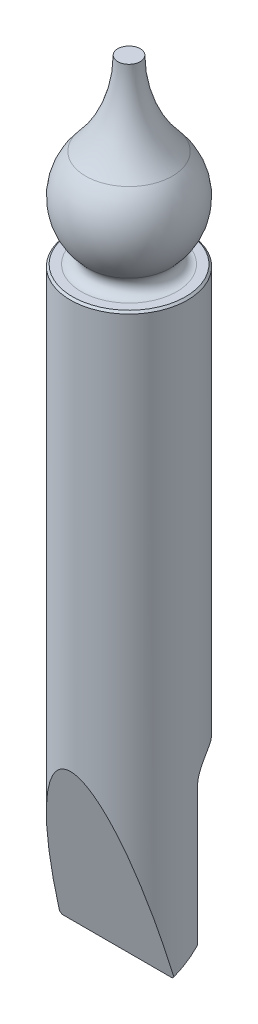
SolidWorks part; units mm, degrees
ref_plane "Спереди" through (0, 0, 0) normal (0, 0, 1) x (1, 0, 0)
ref_plane "Сверху" through (0, 0, 0) normal (0, 1, 0) x (1, 0, 0)
ref_plane "Справа" through (0, 0, 0) normal (1, 0, 0) x (0, 0, -1)
sketch "Эскиз1" plane through (0, 0, 0) normal (0, 0, 1) x (1, 0, 0)
  line L0 (-3, 0) -> (0, 0)
  line L1 (-3, 0) -> (-3, 30)
  line L2 (0, 0) -> (0, 39.2823)
  line L3 (-0.575, 39.2823) -> (0, 39.2823)
  line L4 (-3, 30) -> (-2.4495, 30)
  arc A0 (-2.2219, 35.0157) -> (-2.0996, 30.8571) centre (0, 33) ccw
  arc A1 (-2.2219, 35.0157) -> (-0.575, 39.2823) centre (-6.925, 39.2823) ccw
  arc A2 (-2.4495, 30) -> (-2.0996, 30.8571) centre (-2.4495, 30.5) ccw
  dimension "D3" = 12.7
  dimension "D6" = 1
  dimension "D2" = 3
  dimension "D4" = 0.575
  dimension "D5" = 30
revolve "Повернуть1" add sketch "Эскиз1" angle 360 about L2
sketch "Эскиз3" plane through (0, 0, 0) normal (1, 0, 0) x (0, 0, -1)
  line L0 (-0.6, 5.0601) -> (-0.6, 0) construction
  line L2 (-3, 0) -> (3, 0) construction
  line L4 (0, 0) -> (0, 14.0598) construction
  line L5 (-0.6, 0) -> (-3, 8.9569)
  line L6 (-3, 30) -> (-3, 0) construction
  line L7 (-0.6, 0) -> (0.7, 0.9137)
  line L8 (0.7, 0.9137) -> (0.7, 8)
  line L9 (1.7, 9) -> (3, 9)
  line L10 (3, 0) -> (3, 30) construction
  line L11 (3, 0) -> (3, 30) construction
  line L12 (3, 9) -> (3, -1.2164)
  line L13 (3, -1.2164) -> (-3, -1.2164)
  line L14 (-3, -1.2164) -> (-3, 8.9569)
  arc A0 (0.7, 8) -> (1.7, 9) centre (1.7, 8) cw
  dimension "D4" = 1
  dimension "D1" = 0.6
  dimension "D2" = 2.3
  dimension "D3" = 9
  dimension "D5" = 15
  dimension "D6" = 69.9
extrude "Вырез-Вытянуть1" cut sketch "Эскиз3" against normal mid plane 10
chamfer "Фаска1" distance 0.1 angle 45 8 edges at (0, 30, -3) (-2.9996, 0.4577, -0.0512) (2.9996, 0.4577, -0.0512) (-2.9172, 4.4568, -0.7) (2.9172, 4.4568, -0.7) (2.8393, 8.682, -0.9686) (-2.8013, 8.7796, -1.0738) (0, 9, -3)
